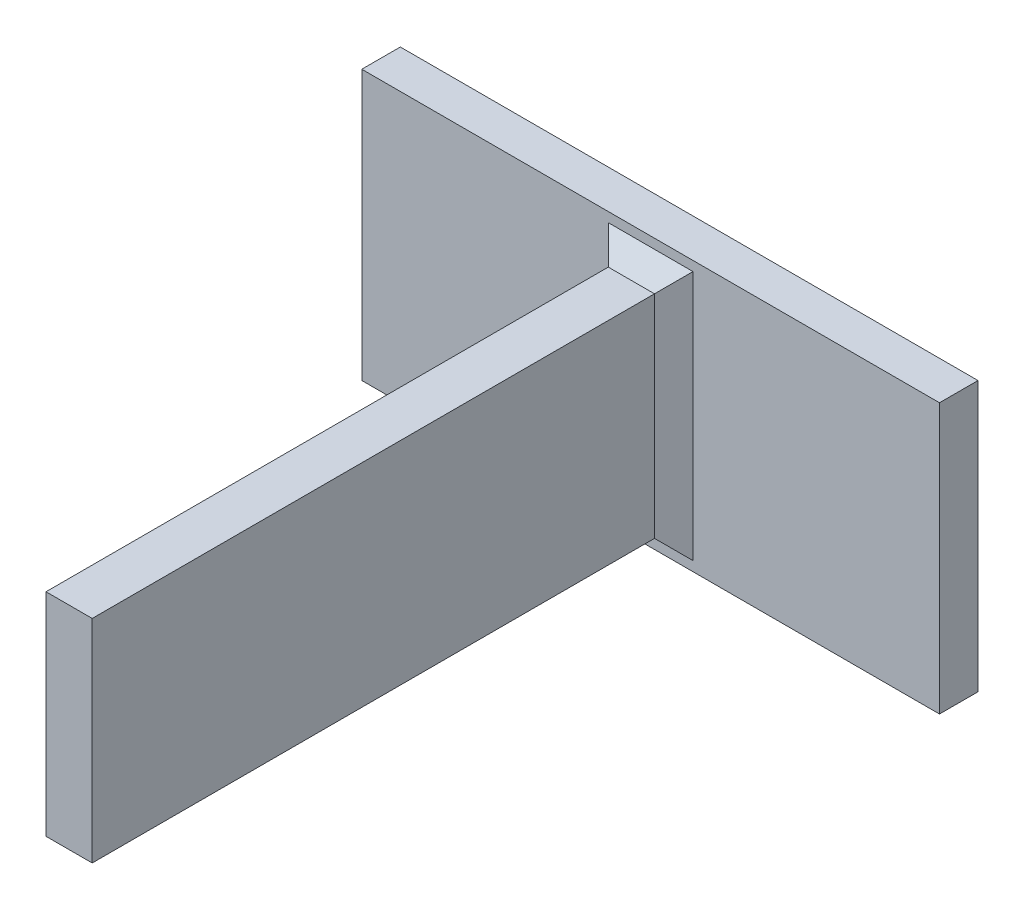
SolidWorks part; units mm, degrees
other "Element opisowy1"
ref_plane "Płaszczyzna przednia" through (0, 0, 0) normal (0, 0, 1) x (1, 0, 0)
ref_plane "Płaszczyzna górna" through (0, 0, 0) normal (0, 1, 0) x (1, 0, 0)
ref_plane "Płaszczyzna prawa" through (0, 0, 0) normal (1, 0, 0) x (0, 0, -1)
sketch "Szkic1" plane through (0, 0, 0) normal (0, 0, 1) x (1, 0, 0)
  line L1 (-75, 35) -> (75, 35)
  line L2 (-75, 35) -> (-75, -35)
  line L3 (-75, -35) -> (75, -35)
  line L4 (75, 35) -> (75, -35)
  line L5 (-75, 35) -> (75, -35) construction
  line L6 (-75, -35) -> (75, 35) construction
  point P0 (0, 0)
extrude "Dodanie-wyciągnięcie1" add sketch "Szkic1" along normal blind 10
ref_plane "Płaszczyzna4" through (0, 0, 11) normal (0, 0, 1) x (1, 0, 0)
sketch "Szkic2" plane through (0, 0, 11) normal (0, 0, 1) x (1, 0, 0)
  line L1 (-6, -27.5) -> (6, -27.5)
  line L2 (-6, -27.5) -> (-6, 27.5)
  line L3 (-6, 27.5) -> (6, 27.5)
  line L4 (6, -27.5) -> (6, 27.5)
  line L5 (-6, -27.5) -> (6, 27.5) construction
  line L6 (-6, 27.5) -> (6, -27.5) construction
  point P0 (0, 0)
extrude "Dodanie-wyciągnięcie2" add sketch "Szkic2" along normal blind 150 separate body
other "Ścieg spoiny pachwinowej1" parameters "D10"=6, "D11"=5, "D12"=0, "D13"=3, "D14"=0
